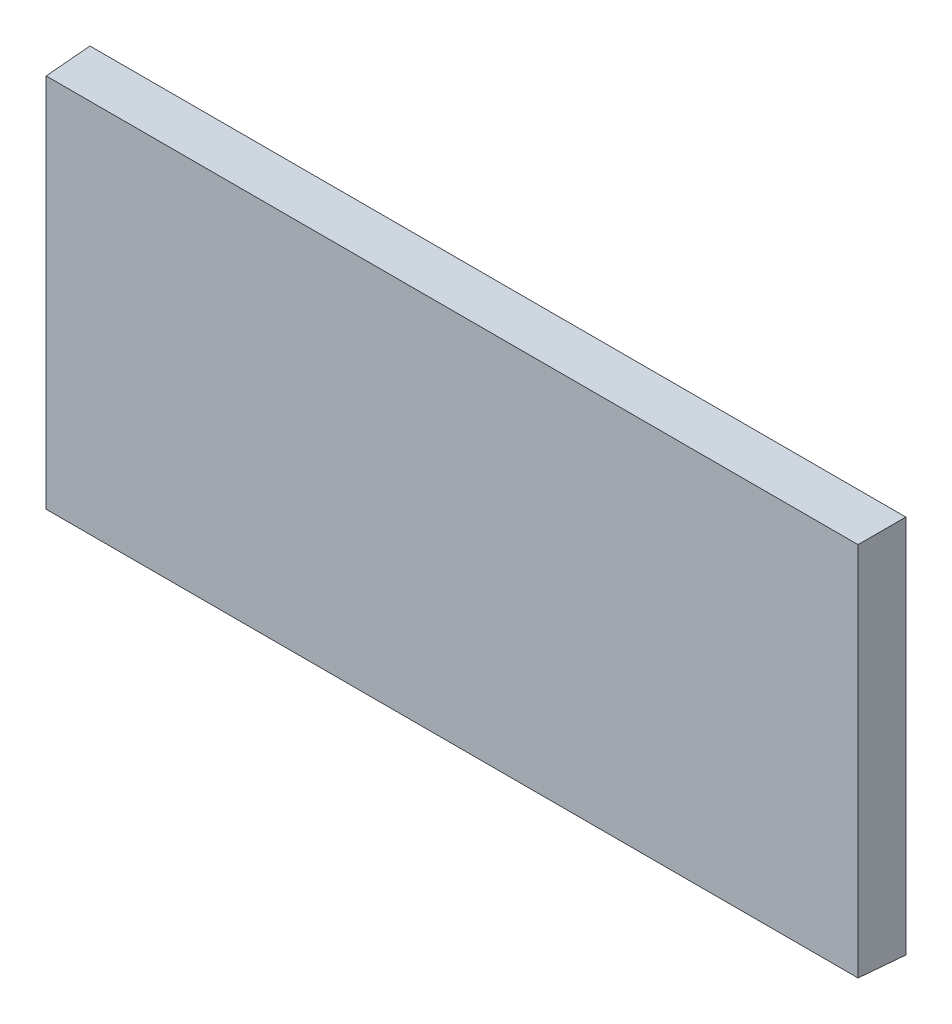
SolidWorks part; units mm, degrees
ref_plane "Front Plane" through (0, 0, 0) normal (0, 0, 1) x (1, 0, 0)
ref_plane "Top Plane" through (0, 0, 0) normal (0, 1, 0) x (1, 0, 0)
ref_plane "Right Plane" through (0, 0, 0) normal (1, 0, 0) x (0, 0, -1)
sketch "Sketch3" plane through (0, 0, 0) normal (0, 0, 1) x (1, 0, 0)
  line L1 (0, 0) -> (119, 0)
  line L2 (0, 0) -> (0, 55.32)
  line L3 (0, 55.32) -> (119, 55.32)
  line L4 (119, 0) -> (119, 55.32)
  dimension "D1" = 119
  dimension "D2" = 55.32
extrude "Extrude2" add sketch "Sketch3" along normal blind 6.68 draft 2.5
shell "Shell4" thickness 2
